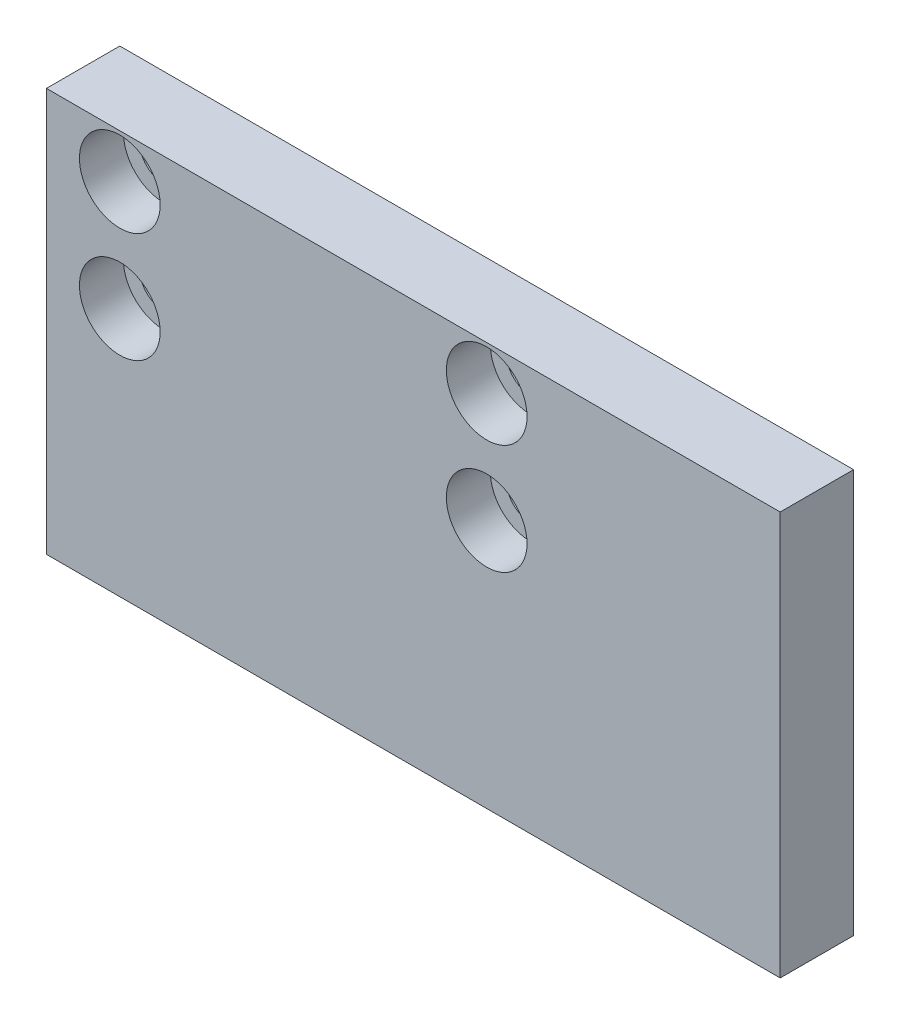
SolidWorks part; units mm, degrees
ref_plane "Face" through (0, 0, 0) normal (0, 0, 1) x (1, 0, 0)
ref_plane "Dessus" through (0, 0, 0) normal (0, 1, 0) x (1, 0, 0)
ref_plane "Droite" through (0, 0, 0) normal (1, 0, 0) x (0, 0, -1)
sketch "Esquisse1" plane through (0, 0, 0) normal (0, 0, 1) x (1, 0, 0)
  line L0 (-20, 27.5) -> (80, -27.5) construction
  line L1 (-20, 27.5) -> (80, 27.5)
  line L2 (-20, 27.5) -> (-20, -27.5)
  line L3 (-20, -27.5) -> (80, -27.5)
  line L4 (80, 27.5) -> (80, -27.5)
  line L5 (-20, 0) -> (0, 0) construction
  dimension "D1" = 100
  dimension "D2" = 55
  dimension "D3" = 20
extrude "Extrusion1" add sketch "Esquisse1" along normal blind 10
hole_wizard "Chambrage pour vis à tête hexagonale M61" positions "Esquisse3" profile "Esquisse2" counterbore size "M6" standard "ISO"
sketch "Esquisse3" plane through (0, 0, 10) normal (0, 0, 1) x (1, 0, 0)
  line L0 (80, 27.5) -> (-20, 27.5) construction
  line L1 (40, 6.5) -> (-10, 6.5) construction
  line L2 (40, 6.5) -> (40, 21.5) construction
  line L3 (40, 21.5) -> (-10, 21.5) construction
  line L4 (-10, 6.5) -> (-10, 21.5) construction
  line L6 (-20, 27.5) -> (-20, -27.5) construction
  point P0 (40, 6.5)
  point P1 (40, 21.5)
  point P2 (-10, 21.5)
  point P3 (-10, 6.5)
  dimension "D1" = 50
  dimension "D2" = 15
  dimension "D3" = 10
  dimension "D4" = 6
sketch "Esquisse2" plane through (40, 6.5, 10) normal (1, 0, 0) x (0, -1, 0)
  line L0 (0, 0) -> (0, 10)
  line L1 (0, 10) -> (3.3, 10)
  line L3 (3.3, 10) -> (3.3, 6)
  line L4 (3.3, 6) -> (5.5, 6)
  line L5 (5.5, 6) -> (5.5, 0)
  line L7 (5.5, 0) -> (0, 0)
  line L11 (0, -6.35) -> (0, 107.95) construction
  dimension "Diamètre du perçage jusqu'au prochain" = 6.6
  dimension "Profondeur du perçage jusqu'au prochain" = 10
  dimension "Diamètre du chambrage" = 11
  dimension "Profondeur du chambrage" = 6
hole_wizard "Trou taraudé M4x0.71" positions "Esquisse5" profile "Esquisse4" tap size "M4x0.7" standard "Ansi Métrique"
sketch "Esquisse5" plane through (-18.185, -27.5, -2.1287) normal (0, 1, 0) x (-1, 0, 0)
  line L0 (-58.185, 7.1287) -> (-93.185, 7.1287) construction
  line L1 (-98.185, 12.1287) -> (-98.185, 2.1287) construction
  line L2 (-75.685, 2.1287) -> (-75.685, 12.1287) construction
  line L3 (-98.185, 12.1287) -> (1.815, 12.1287) construction
  line L4 (-98.185, 2.1287) -> (1.815, 2.1287) construction
  point P0 (-93.185, 7.1287)
  point P1 (-75.685, 7.1287)
  point P2 (-58.185, 7.1287)
  dimension "D1" = 35
  dimension "D2" = 5
sketch "Esquisse4" plane through (75, -27.5, 5) normal (1, 0, 0) x (0, 0, -1)
  line L0 (0, 0) -> (0, 10.9914)
  line L1 (0, 10.9914) -> (1.65, 10)
  line L2 (1.65, 10) -> (1.65, 0)
  line L5 (1.65, 0) -> (0, 0)
  line L10 (0, 10.9914) -> (-1.65, 10) construction
  line L11 (0, -6.35) -> (0, 107.95) construction
  dimension "Diamètre du trou pour taraudage" = 3.3
  dimension "Profondeur du trou pour taraudage" = 10
  dimension "Angle de pointe" = 118
